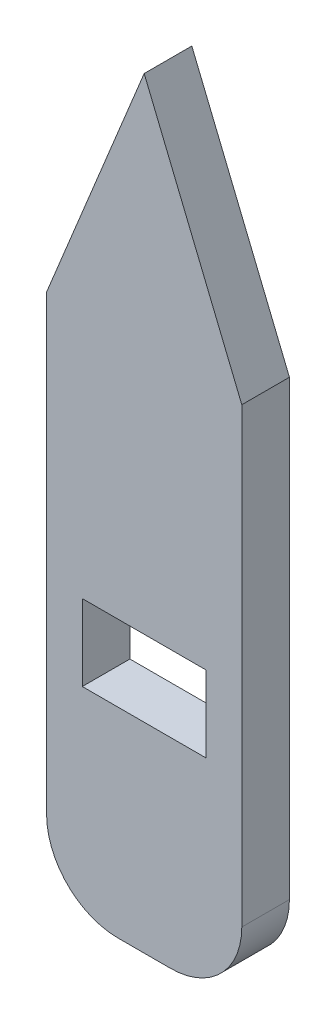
SolidWorks part; units mm, degrees
ref_plane "Plan de face" through (0, 0, 0) normal (0, 0, 1) x (1, 0, 0)
ref_plane "Plan de dessus" through (0, 0, 0) normal (0, 1, 0) x (1, 0, 0)
ref_plane "Plan de droite" through (0, 0, 0) normal (1, 0, 0) x (0, 0, -1)
sketch "Esquisse1" plane through (0, 0, 0) normal (0, 0, 1) x (1, 0, 0)
  line L0 (-4.1, 12) -> (-4.1, -7)
  line L1 (-2.6, 1.6) -> (2.6, 1.6)
  line L2 (-2.6, 1.6) -> (-2.6, -1.6)
  line L3 (-2.6, -1.6) -> (2.6, -1.6)
  line L4 (2.6, 1.6) -> (2.6, -1.6)
  line L5 (-1.1, -10) -> (1.1, -10)
  line L6 (4.1, -7) -> (4.1, 12)
  line L7 (4.1, 12) -> (0, 22)
  line L8 (0, 22) -> (-4.1, 12)
  arc A0 (4.1, -7) -> (1.1, -10) centre (1.1, -7) cw
  arc A1 (-4.1, -7) -> (-1.1, -10) centre (-1.1, -7) ccw
  point P4 (0, 1.6)
  point P6 (-2.6, 0)
  point P9 (0, -10)
  point P18 (-4.1, -10)
  dimension "D7" = 3
  dimension "D1" = 5.2
  dimension "D2" = 3.2
  dimension "D3" = 22
  dimension "D4" = 10
  dimension "D5" = 10
  dimension "D6" = 1.5
extrude "Boss.-Extru.1" add sketch "Esquisse1" along normal blind 2
